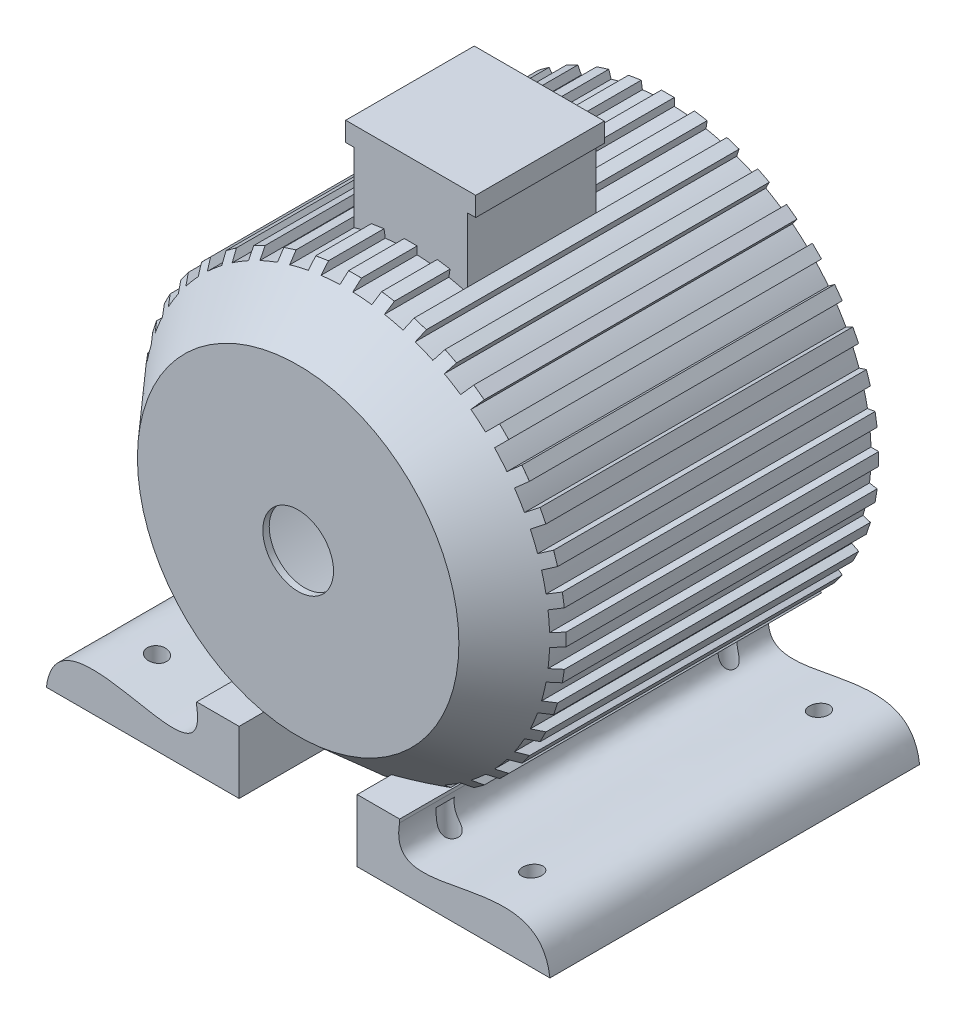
SolidWorks part; units mm, degrees
ref_plane "Front Plane" through (0, 0, 0) normal (0, 0, 1) x (1, 0, 0)
ref_plane "Top Plane" through (0, 0, 0) normal (0, 1, 0) x (1, 0, 0)
ref_plane "Right Plane" through (0, 0, 0) normal (1, 0, 0) x (0, 0, -1)
sketch "Sketch1" plane through (0, 0, 0) normal (0, 1, 0) x (1, 0, 0)
  line L0 (0, 0) -> (250, 0)
  line L1 (250, 0) -> (316.0978, 75.0405)
  line L2 (316.0978, 75.0405) -> (316.0978, 575.0405)
  line L3 (0, 0) -> (0, 575.0405) construction
  line L4 (0, 10) -> (245.4822, 10)
  line L5 (245.4822, 10) -> (306.0978, 78.8166)
  line L6 (306.0978, 78.8166) -> (306.0978, 575.0405)
  line L7 (0, 10) -> (0, 0)
  line L8 (306.0978, 575.0405) -> (316.0978, 575.0405)
  dimension "D1" = 250
  dimension "D2" = 100
  dimension "D3" = 500
  dimension "D4" = 10
revolve "Revolve1" add sketch "Sketch1" angle 360 about L3
sketch "Sketch2" plane through (0, 0, 0) normal (0, 0, 1) x (1, 0, 0)
  circle A0 centre (0, 0) radius 55
  dimension "D1" = 110
extrude "Cut-Extrude1" cut sketch "Sketch2" against normal blind 934
sketch "Sketch3" plane through (0, 0, 0) normal (0, 1, 0) x (1, 0, 0)
  line L0 (-316.0978, 575.0405) -> (-326.0978, 575.0405)
  line L1 (-326.0978, 575.0405) -> (-326.0978, 75.0405)
  line L3 (-316.0978, 575.0405) -> (-316.0978, 75.0405) construction
  line L4 (-326.0978, 75.0405) -> (-259.1283, 0)
  line L5 (-259.1283, 0) -> (-250, 0)
  line L6 (-316.0978, 75.0405) -> (-250, 0)
  line L7 (316.0978, 75.0405) -> (-316.0978, 75.0405) construction
  line L8 (-316.0978, 575.0405) -> (-316.0978, 75.0405)
  dimension "D1" = 10
extrude "Boss-Extrude1" add sketch "Sketch3" along normal blind 10 separate body
sketch "Sketch4" plane through (0, 0, 0) normal (0, 0, 1) x (1, 0, 0)
  line L0 (0, 0) -> (656, 0) construction
  line L1 (328, 10) -> (328, -10)
  line L2 (328, 10) -> (315.9396, 10)
  line L3 (328, -10) -> (315.9396, -10)
  circle A1 centre (0, 0) radius 316.0978 construction
  arc A2 (315.9396, -10) -> (315.9396, 10) centre (0, 0) ccw
  point P4 (328, 0)
  dimension "D2" = 328
  dimension "D1" = 20
extrude "Boss-Extrude2" add sketch "Sketch4" against normal up to surface (575.0405 mm away)
pattern_circular "CirPattern3" count 40 over 360 about axis through (0, 0, 0) along (0, 0, 1) of "Boss-Extrude2"
sketch "Sketch5" plane through (0, 0, 0) normal (0, 1, 0) x (1, 0, 0)
  line L0 (250, 0) -> (328, 0)
  line L1 (250, 0) -> (328, 88.5529)
  line L4 (0, 0) -> (0, 952.2952) construction
  line L5 (328, 88.5529) -> (372.3971, 88.5529)
  line L6 (372.3971, 88.5529) -> (372.3971, -23.8917)
  line L7 (372.3971, -23.8917) -> (250, -35.7844)
  line L8 (250, -35.7844) -> (250, 0)
revolve "Cut-Revolve3" cut sketch "Sketch5" angle 360 about L4
sketch "Sketch8" plane through (0, 0, 0) normal (0, 0, 1) x (1, 0, 0)
  line L0 (91.847, -315.0367) -> (91.847, -379.7918)
  line L1 (91.847, -379.7918) -> (391.6388, -379.7918)
  line L2 (91.847, -315.0367) -> (91.847, -282.563)
  line L3 (91.847, -282.563) -> (157.8189, -282.563)
  line L4 (157.8189, -282.563) -> (157.8189, -287.7102)
  line L5 (0, 0) -> (0, -379.7918) construction
  line L6 (-91.847, -282.563) -> (-157.8189, -282.563)
  line L7 (-91.847, -315.0367) -> (-91.847, -282.563)
  line L8 (-91.847, -315.0367) -> (-91.847, -379.7918)
  line L9 (-91.847, -379.7918) -> (-391.6388, -379.7918)
  line L10 (-157.8189, -282.563) -> (-157.8189, -287.7102)
  spline S0 degree 3 poles (157.8189, -287.7102) (136.0989, -414.2779) (372.7839, -235.1155) (391.6388, -379.7918) knots 0 0 0 0 1 1 1 1
  spline S1 degree 3 poles (-157.8189, -287.7102) (-136.0989, -414.2779) (-372.7839, -235.1155) (-391.6388, -379.7918) knots 0 0 0 0 1 1 1 1
extrude "Boss-Extrude5" add sketch "Sketch8" against normal up to surface (575.0405 mm away)
sketch "Sketch9" plane through (0, -379.7918, 0) normal (0, -1, 0) x (1, 0, 0)
  line L0 (91.847, -575.0405) -> (91.847, 0) construction
  line L1 (0, -15.7606) -> (0, -665.3993) construction
  circle A0 centre (161.847, -72.1968) radius 15
  circle A1 centre (153.7454, -511.054) radius 15
  circle A2 centre (291.847, -72.1968) radius 15
  circle A3 centre (299.0353, -511.054) radius 15
  circle A6 centre (-153.7454, -511.054) radius 15
  circle A7 centre (-299.0353, -511.054) radius 15
  circle A8 centre (-291.847, -72.1968) radius 15
  circle A9 centre (-161.847, -72.1968) radius 15
  dimension "D1" = 30
  dimension "D2" = 30
  dimension "D3" = 30
  dimension "D4" = 30
  dimension "D6" = 130
  dimension "D5" = 70
extrude "Cut-Extrude3" cut sketch "Sketch9" against normal blind 83
ref_plane "Plane1" through (0, 0, -375.0405) normal (0, 0, -1) x (-1, 0, 0)
sketch "Sketch10" plane through (0, 0, -375.0405) normal (0, 0, -1) x (-1, 0, 0)
  line L0 (0, 0) -> (0, 452.3858) construction
  line L1 (88.1201, 303.5666) -> (-88.1201, 303.5666)
  line L2 (-88.1201, 303.5666) -> (-88.1201, 411.7413)
  line L4 (88.1201, 303.5666) -> (88.1201, 411.7413)
  line L5 (-88.1201, 411.7413) -> (-101.1201, 411.7413)
  line L6 (-101.1201, 411.7413) -> (-101.1201, 441.7413)
  line L7 (-101.1201, 441.7413) -> (101.1201, 441.7413)
  line L8 (101.1201, 441.7413) -> (101.1201, 411.7413)
  line L9 (101.1201, 411.7413) -> (88.1201, 411.7413)
  dimension "D1" = 13
  dimension "D2" = 30
  dimension "D3" = 13
extrude "Boss-Extrude6" add sketch "Sketch10" against normal blind 200
